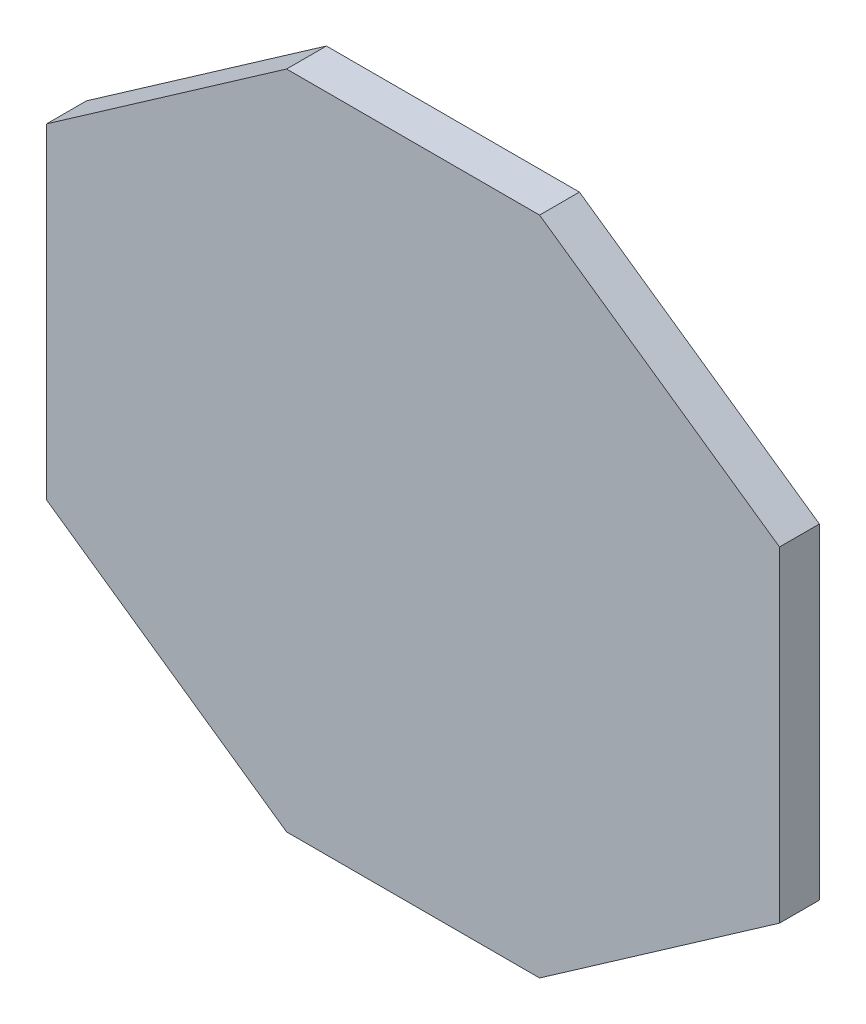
SolidWorks part; units mm, degrees
ref_plane "Front Plane" through (0, 0, 0) normal (1, 0, 0) x (0, 1, 0)
ref_plane "Top Plane" through (0, 0, 0) normal (0, 0, 1) x (0, 1, 0)
ref_plane "Right Plane" through (0, 0, 0) normal (0, 1, 0) x (-1, 0, 0)
sketch "Sketch1" plane through (0, 0, 0) normal (0, 0, 1) x (0, 1, 0)
  line L12 (-230.378, 287.909) -> (230.378, -287.909)
  point P2 (0, 0)
  line B0 (256.385, 577.8303) -> (520.2993, 199.6773)
  line B1 (520.2993, 199.6773) -> (520.2993, -199.6773)
  line B2 (520.2993, -199.6773) -> (256.385, -577.8303)
  line B3 (256.385, -577.8303) -> (-256.385, -577.8303)
  line B4 (-256.385, -577.8303) -> (-520.2993, -199.6773)
  line B5 (-520.2993, -199.6773) -> (-520.2993, 199.6773)
  line B6 (-520.2993, 199.6773) -> (-256.385, 577.8303)
  line B7 (-256.385, 577.8303) -> (256.385, 577.8303)
  line B8 (-54.229, 156.845) -> (-230.378, 156.845)
  line B9 (-230.378, 156.845) -> (-230.378, 287.909)
  line B10 (230.378, 156.845) -> (54.229, 156.845)
  line B11 (230.378, 287.909) -> (230.378, 156.845)
  line B12 (-230.378, 287.909) -> (230.378, 287.909)
  line B13 (54.229, -156.845) -> (230.378, -156.845)
  line B14 (230.378, -156.845) -> (230.378, -287.909)
  line B15 (230.378, -287.909) -> (-230.378, -287.909)
  line B16 (-230.378, -287.909) -> (-230.378, -156.845)
  line B17 (-230.378, -156.845) -> (-54.229, -156.845)
  line B18 (42.164, 144.78) -> (42.164, -144.78)
  line B19 (-54.229, 156.845) -> (-42.164, 144.78)
  line B20 (-42.164, -144.78) -> (-42.164, 144.78)
  line B21 (42.164, 144.78) -> (54.229, 156.845)
  line B22 (42.164, -144.78) -> (54.229, -156.845)
  line B23 (-54.229, -156.845) -> (-42.164, -144.78)
  circle B24 centre (173.5887, 419.0803) radius 158.75 construction
  circle B25 centre (-173.5887, 419.0803) radius 158.75 construction
  circle B26 centre (-361.5493, 149.7586) radius 158.75 construction
  circle B27 centre (-361.5493, -149.7586) radius 158.75 construction
  circle B28 centre (-173.5887, -419.0803) radius 158.75 construction
  circle B29 centre (173.5887, -419.0803) radius 158.75 construction
  circle B30 centre (361.5493, -149.7586) radius 158.75 construction
  circle B31 centre (361.5493, 149.7586) radius 158.75 construction
sketch_block_instance "Block1-1"
sketch_block "Block1"
sketch "Sketch2" plane through (0, 0, 0) normal (0, 0, 1) x (0, 1, 0)
  line L16 (-259.6446, 584.0803) -> (-526.5493, 201.6426)
  line L17 (-526.5493, 201.6426) -> (-526.5493, -201.6426)
  line L18 (-526.5493, -201.6426) -> (-259.6446, -584.0803)
  line L19 (-259.6446, -584.0803) -> (259.6446, -584.0803)
  line L20 (259.6446, -584.0803) -> (526.5493, -201.6426)
  line L21 (526.5493, -201.6426) -> (526.5493, 201.6426)
  line L22 (526.5493, 201.6426) -> (259.6446, 584.0803)
  line L23 (259.6446, 584.0803) -> (-259.6446, 584.0803)
  line L24 (-259.6446, 584.0803) -> (-526.5493, 201.6426)
  line L25 (-526.5493, 201.6426) -> (-526.5493, -201.6426)
  line L26 (-526.5493, -201.6426) -> (-259.6446, -584.0803)
  line L27 (-259.6446, -584.0803) -> (259.6446, -584.0803)
  line L28 (259.6446, -584.0803) -> (526.5493, -201.6426)
  line L29 (526.5493, -201.6426) -> (526.5493, 201.6426)
  line L30 (526.5493, 201.6426) -> (259.6446, 584.0803)
  line L31 (259.6446, 584.0803) -> (-259.6446, 584.0803)
  dimension "D1" = 6.25
extrude "Boss-Extrude1" add sketch "Sketch2" against normal blind 63.5
